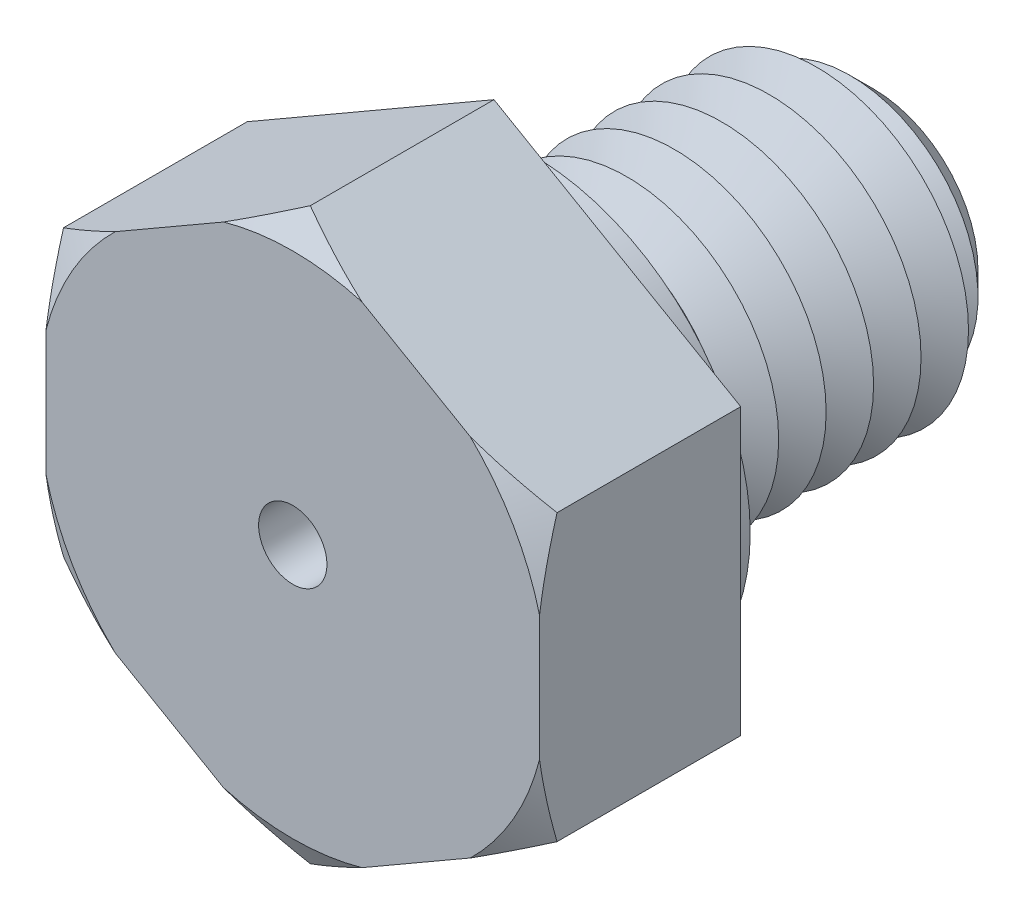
SolidWorks part; units mm, degrees
ref_plane "Front Plane" through (0, 0, 0) normal (0, 0, 1) x (1, 0, 0)
ref_plane "Top Plane" through (0, 0, 0) normal (0, 1, 0) x (1, 0, 0)
ref_plane "Right Plane" through (0, 0, 0) normal (1, 0, 0) x (0, 0, -1)
sketch "Sketch2" plane through (0, 0, 0) normal (0, 0, 1) x (1, 0, 0)
  line L1 (0, 7.5056) -> (-6.5, 3.7528)
  line L2 (-6.5, 3.7528) -> (-6.5, -3.7528)
  line L3 (-6.5, -3.7528) -> (0, -7.5056)
  line L4 (0, -7.5056) -> (6.5, -3.7528)
  line L5 (6.5, -3.7528) -> (6.5, 3.7528)
  line L6 (6.5, 3.7528) -> (0, 7.5056)
  circle A0 centre (0, 0) radius 6.5 construction
  dimension "D1" = 13
extrude "Boss-Extrude1" add sketch "Sketch2" along normal blind 5.3
sketch "Sketch3" plane through (0, 0, 0) normal (0, 0, -1) x (-1, 0, 0)
  circle A0 centre (0, 0) radius 4
  dimension "D1" = 8
extrude "Boss-Extrude2" add sketch "Sketch3" along normal blind 10
sketch "Sketch4" plane through (0, 0, 0) normal (0, 0, -1) x (-1, 0, 0)
  circle A0 centre (0, 0) radius 5.75
  dimension "D1" = 11.5
extrude "Boss-Extrude3" add sketch "Sketch4" along normal blind 1
sketch "Sketch5" plane through (0, 0, 0) normal (1, 0, 0) x (0, 0, -1)
  line L0 (-3.2117, 0) -> (6.3192, 0) construction
chamfer "Chamfer1" distance 1.25 angle 45 1 edges at (-4, 0, -10)
sketch "Sketch6" plane through (0, 0, 0) normal (1, 0, 0) x (0, 0, -1)
  line L0 (1, 4) -> (1.625, 2.9175)
  line L1 (1.625, 2.9175) -> (2.25, 4)
  line L2 (8.75, 4) -> (1, 4) construction
  line L3 (2.25, 4) -> (1, 4)
  dimension "D1" = 1.25
revolve "Cut-Revolve1" cut sketch "Sketch6" angle 360 about L0
pattern_linear "LPattern1" count 7 spacing 1.25 along (0, 0, -1) of "Cut-Revolve1"
sketch "Sketch7" plane through (0, 0, 0) normal (1, 0, 0) x (0, 0, -1)
  line L0 (-5.3, 7.5056) -> (-5.3, 6.7056)
  line L1 (-5.3, 3.7528) -> (-5.3, 7.5056) construction
  line L2 (-5.3, 6.7056) -> (-4.8381, 7.5056)
  line L3 (-5.3, 7.5056) -> (0, 7.5056) construction
  line L4 (-4.8381, 7.5056) -> (-5.3, 7.5056)
  dimension "D1" = 0.8
  dimension "D2" = 30
revolve "Cut-Revolve2" cut sketch "Sketch7" angle 360 about L0
sketch "Sketch8" plane through (0, 0, 5.3) normal (0, 0, 1) x (1, 0, 0)
  circle A0 centre (0, 0) radius 0.9
  dimension "D1" = 1.8
extrude "Cut-Extrude1" cut sketch "Sketch8" against normal up to surface (15.3 mm away)
